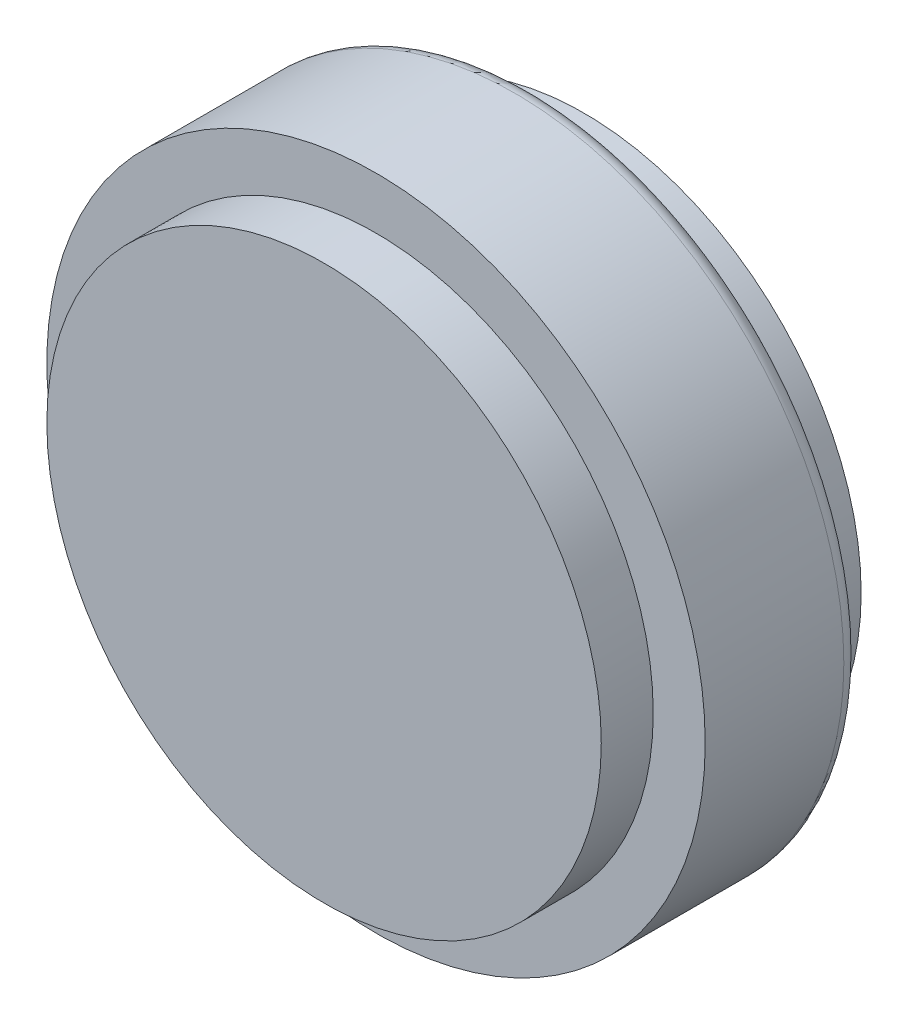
SolidWorks part; units mm, degrees
ref_plane "Front" through (0, 0, 0) normal (0, 0, 1) x (1, 0, 0)
ref_plane "Top" through (0, 0, 0) normal (0, 1, 0) x (1, 0, 0)
ref_plane "Right" through (0, 0, 0) normal (1, 0, 0) x (0, 0, -1)
sketch "Sketch2" plane through (0, 0, 0) normal (1, 0, 0) x (0, 0, -1)
  line L0 (0, 0) -> (67.6083, 0) construction
  line L1 (7.5, 0) -> (7.5, 19) construction
  line L2 (0, 0) -> (15, 0)
  line L3 (0, 0) -> (0, 16)
  line L4 (0, 16) -> (3, 16)
  line L5 (15, 0) -> (15, 16)
  line L7 (3, 16) -> (3, 19)
  line L8 (3, 19) -> (12, 19)
  line L9 (12, 16) -> (12, 19)
  line L10 (12, 16) -> (15, 16)
  dimension "D1" = 16
  dimension "D2" = 3
  dimension "D3" = 15
revolve "Revolve1" add sketch "Sketch2" angle 360 about L0
fillet "Fillet1" radius 1 1 edges at (19, 0, -12)
scale "Scale1" scale about centroid uniform scaling yes scale factor 2
